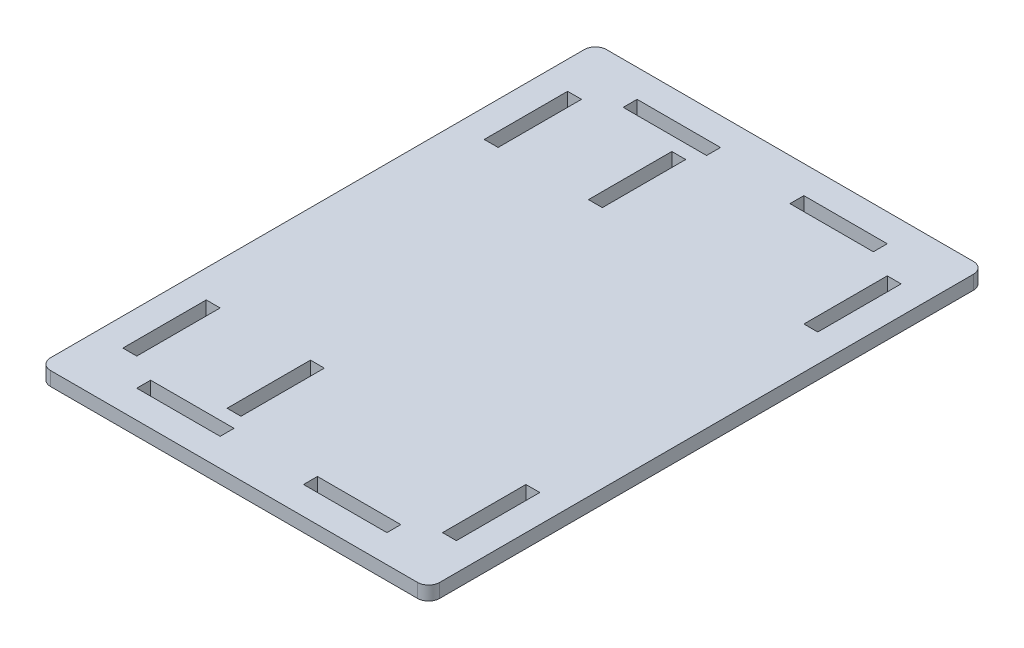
SolidWorks part; units mm, degrees
ref_plane "Front Plane" through (0, 0, 0) normal (0, 0, 1) x (1, 0, 0)
ref_plane "Top Plane" through (0, 0, 0) normal (0, 1, 0) x (1, 0, 0)
ref_plane "Right Plane" through (0, 0, 0) normal (1, 0, 0) x (0, 0, -1)
sketch "Sketch1" plane through (0, 0, 0) normal (0, 1, 0) x (1, 0, 0)
  line L0 (88.9, 0) -> (88.9, 127)
  line L1 (0, 0) -> (88.9, 0)
  line L2 (0, 0) -> (0, 127)
  line L3 (88.9, 127) -> (0, 127)
  dimension "D1" = 88.9
  dimension "D2" = 127
extrude "Boss-Extrude1" add sketch "Sketch1" along normal blind 3.175
sketch "Sketch2" plane through (0, 3.175, 0) normal (0, 1, 0) x (1, 0, 0)
  line L0 (88.9, 127) -> (0, 127) construction
  line L1 (6.35, 114.3) -> (9.525, 114.3)
  line L2 (6.35, 114.3) -> (6.35, 95.25)
  line L3 (6.35, 95.25) -> (9.525, 95.25)
  line L4 (9.525, 114.3) -> (9.525, 95.25)
  line L5 (0, 127) -> (0, 0) construction
  line L6 (44.45, 127) -> (44.45, 0) construction
  line L7 (0, 0) -> (88.9, 0) construction
  line L8 (0, 63.5) -> (88.9, 63.5) construction
  line L9 (88.9, 0) -> (88.9, 127) construction
  line L10 (79.375, 114.3) -> (79.375, 95.25)
  line L11 (82.55, 95.25) -> (79.375, 95.25)
  line L12 (82.55, 114.3) -> (82.55, 95.25)
  line L13 (82.55, 114.3) -> (79.375, 114.3)
  line L14 (82.55, 12.7) -> (79.375, 12.7)
  line L15 (82.55, 12.7) -> (82.55, 31.75)
  line L16 (82.55, 31.75) -> (79.375, 31.75)
  line L17 (79.375, 12.7) -> (79.375, 31.75)
  line L18 (9.525, 12.7) -> (9.525, 31.75)
  line L19 (6.35, 31.75) -> (9.525, 31.75)
  line L20 (6.35, 12.7) -> (6.35, 31.75)
  line L21 (6.35, 12.7) -> (9.525, 12.7)
  line L22 (53.975, 120.65) -> (53.975, 117.475)
  line L23 (15.875, 120.65) -> (34.925, 120.65)
  line L24 (15.875, 120.65) -> (15.875, 117.475)
  line L25 (15.875, 117.475) -> (34.925, 117.475)
  line L26 (34.925, 120.65) -> (34.925, 117.475)
  line L27 (73.025, 117.475) -> (53.975, 117.475)
  line L28 (73.025, 120.65) -> (73.025, 117.475)
  line L29 (73.025, 120.65) -> (53.975, 120.65)
  line L30 (73.025, 6.35) -> (53.975, 6.35)
  line L31 (73.025, 6.35) -> (73.025, 9.525)
  line L32 (73.025, 9.525) -> (53.975, 9.525)
  line L33 (34.925, 6.35) -> (34.925, 9.525)
  line L34 (15.875, 9.525) -> (34.925, 9.525)
  line L35 (15.875, 6.35) -> (15.875, 9.525)
  line L36 (15.875, 6.35) -> (34.925, 6.35)
  line L37 (53.975, 6.35) -> (53.975, 9.525)
  line L38 (33.3375, 12.7) -> (33.3375, 31.75)
  line L39 (30.1625, 114.3) -> (33.3375, 114.3)
  line L40 (30.1625, 114.3) -> (30.1625, 95.25)
  line L41 (30.1625, 95.25) -> (33.3375, 95.25)
  line L42 (33.3375, 114.3) -> (33.3375, 95.25)
  line L43 (30.1625, 31.75) -> (33.3375, 31.75)
  line L44 (30.1625, 12.7) -> (30.1625, 31.75)
  line L45 (30.1625, 12.7) -> (33.3375, 12.7)
  point P48 (31.75, 114.3)
  dimension "D1" = 3.175
  dimension "D2" = 19.05
  dimension "D3" = 12.7
  dimension "D4" = 6.35
  dimension "D5" = 6.35
  dimension "D6" = 19.05
  dimension "D7" = 3.175
  dimension "D8" = 6.35
  dimension "D9" = 3.175
  dimension "D10" = 19.05
  dimension "D11" = 57.15
extrude "Cut-Extrude1" cut sketch "Sketch2" against normal through all
fillet "Fillet1" radius 2.54 4 edges at (0, 1.5875, 0) (88.9, 1.5875, 0) (88.9, 1.5875, -127) (0, 1.5875, -127)
